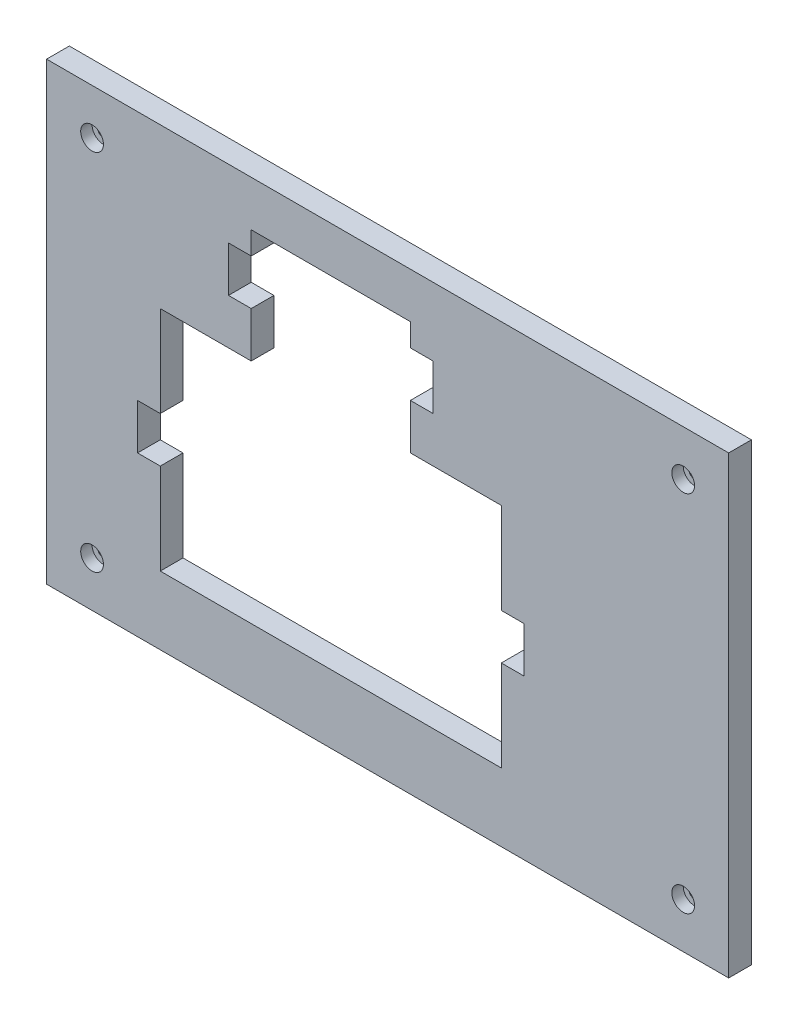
SolidWorks part; units mm, degrees
ref_plane "Plan de face" through (0, 0, 0) normal (0, 0, 1) x (1, 0, 0)
ref_plane "Plan de dessus" through (0, 0, 0) normal (0, 1, 0) x (1, 0, 0)
ref_plane "Plan de droite" through (0, 0, 0) normal (1, 0, 0) x (0, 0, -1)
sketch "Esquisse1" plane through (0, 0, 0) normal (0, 0, 1) x (1, 0, 0)
  line L1 (0, 0) -> (300, 0)
  line L2 (0, 0) -> (0, 200)
  line L3 (0, 200) -> (300, 200)
  line L4 (300, 0) -> (300, 200)
  dimension "D1" = 300
  dimension "D2" = 200
extrude "Extrusion1" add sketch "Esquisse1" against normal blind 10
sketch "Esquisse2" plane through (0, 0, 0) normal (0, 0, 1) x (1, 0, 0)
  line L0 (125, 213.5042) -> (125, -13.5042) construction
  line L1 (300, 0) -> (300, 200) construction
  line L2 (50, 30) -> (200, 30)
  line L3 (0, 0) -> (300, 0) construction
  line L4 (200, 30) -> (200, 70)
  line L5 (200, 70) -> (210, 70)
  line L6 (210, 70) -> (210, 90)
  line L7 (210, 90) -> (200, 90)
  line L8 (200, 90) -> (200, 130)
  line L9 (200, 130) -> (160, 130)
  line L10 (160, 130) -> (160, 150)
  line L11 (160, 150) -> (170, 150)
  line L12 (170, 150) -> (170, 170)
  line L13 (170, 170) -> (160, 170)
  line L14 (160, 170) -> (160, 180)
  line L15 (160, 180) -> (90, 180)
  line L18 (90, 170) -> (90, 180)
  line L19 (80, 170) -> (90, 170)
  line L20 (80, 150) -> (80, 170)
  line L21 (90, 150) -> (80, 150)
  line L22 (90, 130) -> (90, 150)
  line L23 (50, 130) -> (90, 130)
  line L24 (50, 90) -> (50, 130)
  line L25 (40, 90) -> (50, 90)
  line L26 (40, 70) -> (40, 90)
  line L27 (50, 70) -> (40, 70)
  line L28 (50, 30) -> (50, 70)
  point P21 (125, 180)
  point P32 (125, 30)
  dimension "D1" = 175
  dimension "D2" = 30
  dimension "D3" = 75
  dimension "D4" = 40
  dimension "D5" = 10
  dimension "D6" = 20
  dimension "D7" = 40
  dimension "D8" = 20
  dimension "D9" = 10
  dimension "D10" = 20
  dimension "D11" = 35
  dimension "D12" = 10
extrude "Enlèv. mat.-Extru.1" cut sketch "Esquisse2" against normal through all
sketch "Esquisse4" plane through (0, 0, 0) normal (0, 0, 1) x (1, 0, 0)
  line L0 (0, 200) -> (0, 0) construction
  line L1 (300, 200) -> (0, 200) construction
  circle A0 centre (20, 180) radius 5
  dimension "D3" = 10
  dimension "D1" = 20
  dimension "D2" = 20
extrude "Enlèv. mat.-Extru.2" cut sketch "Esquisse4" against normal blind 5
sketch "Esquisse5" plane through (0, 0, -5) normal (0, 0, 1) x (1, 0, 0)
  circle A0 centre (20, 180) radius 2.5
  circle A1 centre (20, 180) radius 5 construction
  dimension "D1" = 5
extrude "Enlèv. mat.-Extru.3" cut sketch "Esquisse5" against normal through all
pattern_linear "Répétition linéaire1" count 2 spacing 260 along (1, 0, 0) count 2 spacing 160 along (0, -1, 0) of "Enlèv. mat.-Extru.2", "Enlèv. mat.-Extru.3"
